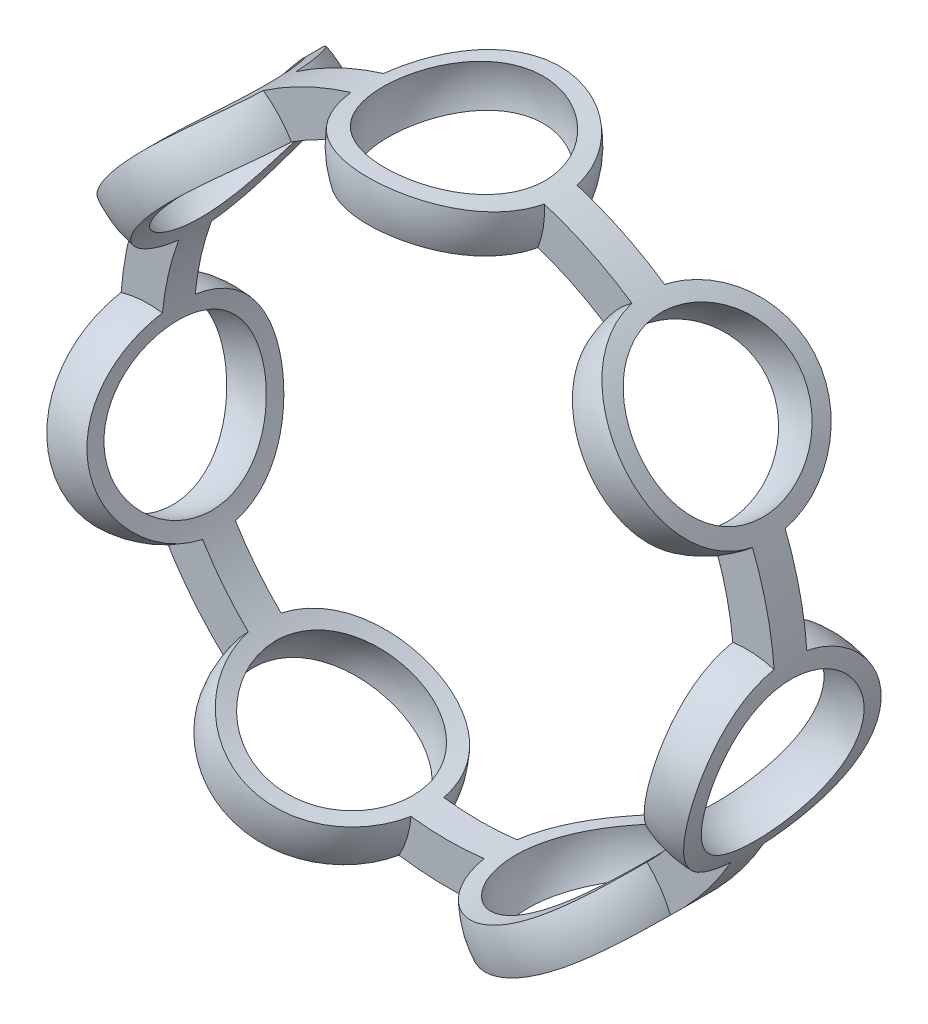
SolidWorks part; units mm, degrees
ref_plane "Plan1" through (0, 0, 0) normal (0, 0, 1) x (1, 0, 0)
ref_plane "Plan2" through (0, 0, 0) normal (0, 1, 0) x (1, 0, 0)
ref_plane "Plan3" through (0, 0, 0) normal (1, 0, 0) x (0, 0, -1)
sketch "Esquisse1" plane through (0, 0, 0) normal (0, 0, 1) x (1, 0, 0)
  circle A0 centre (0, 0) radius 7.5
  dimension "D1" = 15
extrude "Base-Extru.-Mince" add sketch "Esquisse1" along normal mid plane 0.8 thin
sketch "Esquisse2" plane through (0, 0, 0) normal (0, 0, 1) x (1, 0, 0)
  line L0 (0, 1.0573) -> (0, 12.0999) construction
  line L2 (0, 9.9) -> (0, 5.1)
  arc A1 (0, 9.9) -> (0, 5.1) centre (0, 7.5) ccw
  dimension "D2" = 2.4
  dimension "D1" = 7.5
revolve "Boss.-Révol.1" add sketch "Esquisse2" angle 360 about L0
sketch "Esquisse3" plane through (0, 0, 0) normal (0, 0, 1) x (1, 0, 0)
  line L0 (0, 12.2917) -> (0, 1.0573) construction
  line L1 (0, 1.0573) -> (0, 12.0999) construction
  line L2 (0, 5.5) -> (0, 9.5)
  arc A0 (0, 9.5) -> (0, 5.5) centre (0, 7.5) ccw
  arc A1 (2.3963, 7.6327) -> (-2.3963, 7.6327) centre (0, 7.5) ccw construction
  dimension "D1" = 2
revolve "Enlèvement de matière-Révolution2" cut sketch "Esquisse3" angle 360 about L0
pattern_circular "Répétition circulaire1" count 7 over 360 about axis through (0, 0, 0) along (0, 0, 1) of "Enlèvement de matière-Révolution2", "Boss.-Révol.1"
sketch "Esquisse4" plane through (0, 0, 0) normal (0, 0, 1) x (1, 0, 0)
  circle A0 centre (0, 0) radius 7
  circle A1 centre (0, 0) radius 8
  dimension "D1" = 14
  dimension "D2" = 16
extrude "Enlèv. mat.-Extru.1" cut sketch "Esquisse4" against normal mid plane 10 flip side to cut
